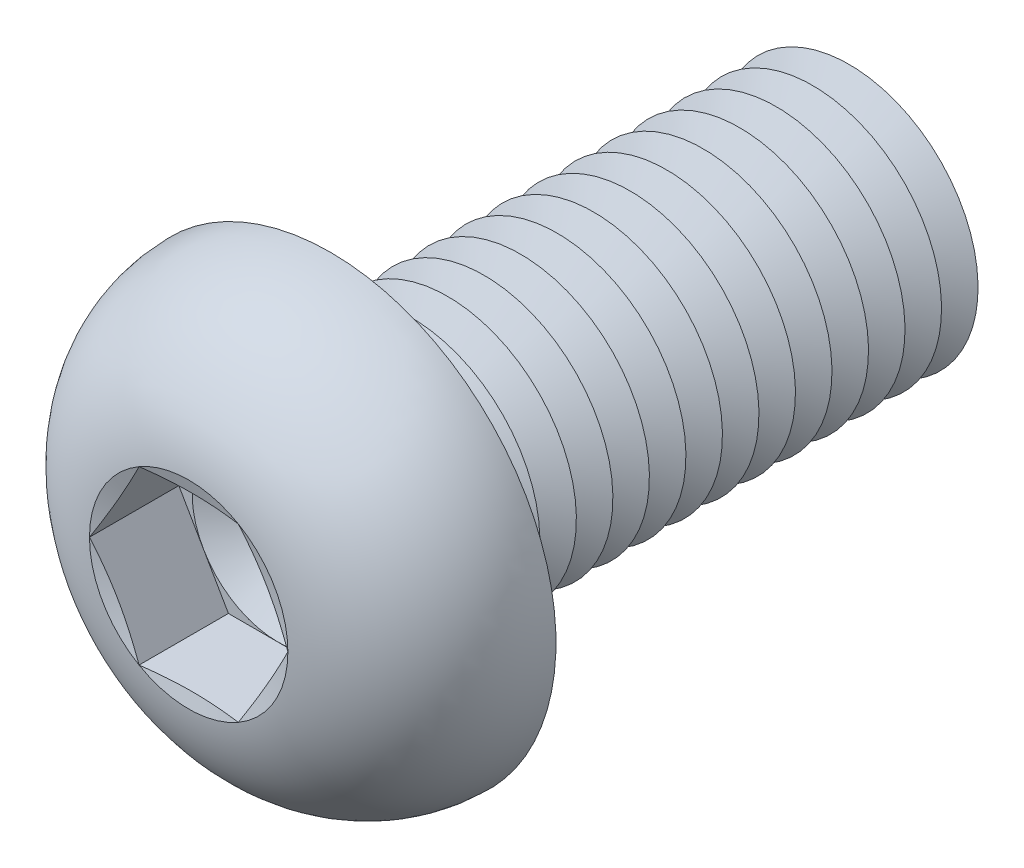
SolidWorks part; units mm, degrees
ref_plane "Front Plane" through (0, 0, 0) normal (0, 0, 1) x (1, 0, 0)
ref_plane "Top Plane" through (0, 0, 0) normal (0, 1, 0) x (1, 0, 0)
ref_plane "Right Plane" through (0, 0, 0) normal (1, 0, 0) x (0, 0, -1)
sketch "Sketch1" plane through (0, 0, 0) normal (1, 0, 0) x (0, 0, -1)
  line L0 (0, 6) -> (0, 10.5)
  line L3 (0, 6) -> (25, 6)
  line L4 (25, 6) -> (25, 0)
  line L5 (25, 0) -> (-6.6, 0) construction
  line L6 (-6.6, 0) -> (25, 0)
  line L7 (-6.6, 4.6188) -> (-6.6, 2.3094) construction
  line L8 (-6.6, 2.3094) -> (-6.6, 0)
  line L9 (-6.6, 4.6188) -> (-5.9812, 2.3094)
  line L10 (-5.9812, 2.3094) -> (-6.6, 2.3094)
  line L11 (25, 0) -> (22.7481, 0) construction
  line L12 (0, 10.5) -> (-6.6, 10.5) construction
  arc A1 (0, 10.5) -> (-6.6, 4.6188) centre (0, 3.8561) ccw
  point P8 (25, 3)
  dimension "D1" = 21
  dimension "D2" = 12
  dimension "D3" = 6.6
  dimension "D4" = 9.2376
  dimension "D5" = 25
  dimension "D6" = 15
revolve "Revolve1" add sketch "Sketch1" angle 360 about L5
fillet "Fillet1" radius 0.85 1 edges at (0, 6, 0)
sketch "Sketch2" plane through (0, 0, 0) normal (1, 0, 0) x (0, 0, -1)
  line L0 (24.15, 6) -> (25.85, 6)
  line L1 (25, 6) -> (0.85, 6) construction
  line L2 (25.85, 6) -> (25, 4.5278)
  line L3 (25, -6) -> (25, 6) construction
  line L4 (25, 4.5278) -> (24.15, 6)
  dimension "D1" = 1.7
revolve "Cut-Revolve1" cut sketch "Sketch2" angle 360 about axis through (0, 0, -25) along (0, 0, -1)
pattern_linear "LPattern1" count 14 spacing 1.7 along (0, 0, 1) of "Cut-Revolve1"
sketch "Sketch3" plane through (0, 0, 6.6) normal (0, 0, 1) x (1, 0, 0)
  line L7 (2.3094, 4) -> (-2.3094, 4)
  line L8 (-2.3094, 4) -> (-4.6188, 0)
  line L9 (-4.6188, 0) -> (-2.3094, -4)
  line L10 (-2.3094, -4) -> (2.3094, -4)
  line L11 (2.3094, -4) -> (4.6188, 0)
  line L12 (4.6188, 0) -> (2.3094, 4)
  circle A0 centre (0, 0) radius 4 construction
  circle A3 centre (0, 0) radius 4.6188 construction
extrude "Cut-Extrude1" cut sketch "Sketch3" against normal blind 4.16
sketch "Sketch4" plane through (0, 0, 2.44) normal (0, 0, 1) x (1, 0, 0)
  line L1 (2.3094, 4) -> (-2.3094, 4) construction
  circle A0 centre (0, 0) radius 4
extrude "Cut-Extrude2" cut sketch "Sketch4" against normal through all draft 60
